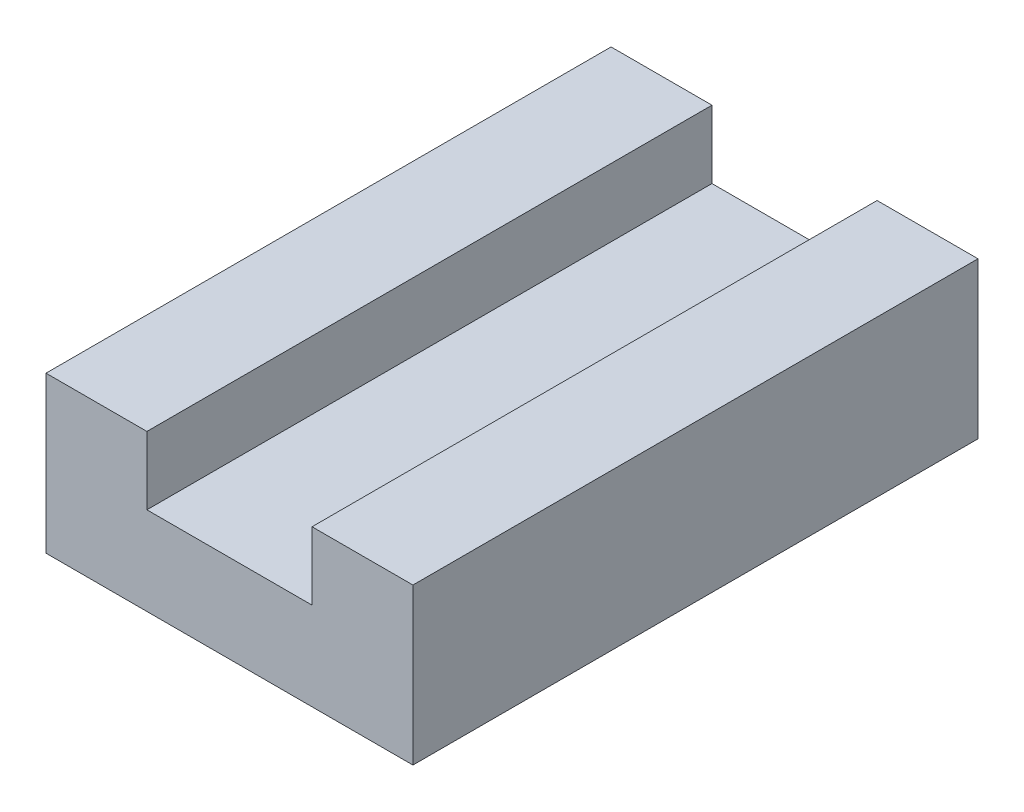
SolidWorks part; units mm, degrees
ref_plane "Front Plane" through (0, 0, 0) normal (0, 0, 1) x (1, 0, 0)
ref_plane "Top Plane" through (0, 0, 0) normal (0, 1, 0) x (1, 0, 0)
ref_plane "Right Plane" through (0, 0, 0) normal (1, 0, 0) x (0, 0, -1)
sketch "Sketch1" plane through (0, 0, 0) normal (1, 0, 0) x (0, 0, -1)
  line L1 (0, 0) -> (30.8, 0)
  line L2 (0, 0) -> (0, 8.5)
  line L3 (0, 8.5) -> (30.8, 8.5)
  line L4 (30.8, 0) -> (30.8, 8.5)
  dimension "D1" = 30.8
  dimension "D2" = 8.5
extrude "Boss-Extrude1" add sketch "Sketch1" along normal mid plane 20
sketch "Sketch2" plane through (0, 8.5, 0) normal (0, 1, 0) x (1, 0, 0)
  line L0 (10, 0) -> (-10, 0) construction
  line L1 (-4.5, 0) -> (4.5, 0)
  line L2 (-4.5, 0) -> (-4.5, 30.8)
  line L3 (-4.5, 30.8) -> (4.5, 30.8)
  line L4 (4.5, 0) -> (4.5, 30.8)
  line L5 (10, 30.8) -> (-10, 30.8) construction
  line L6 (10, 30.8) -> (10, 0) construction
  dimension "D1" = 9
  dimension "D2" = 5.5
extrude "Cut-Extrude1" cut sketch "Sketch2" against normal blind 3.7
hole_wizard "M3x0.5 Tapped Hole1" positions "Sketch4" profile "Sketch3" tap size "M3x0.5" standard "ANSI Metric"
sketch "Sketch4" plane through (0, 0, 0) normal (0, -1, 0) x (-1, 0, 0)
  line L0 (7.5, 10.4) -> (-7.5, 10.4) construction
  line L1 (-7.5, 10.4) -> (-7.5, 20.4) construction
  line L2 (-7.5, 20.4) -> (7.5, 20.4) construction
  line L3 (7.5, 20.4) -> (7.5, 10.4) construction
  line L5 (-10, 30.8) -> (10, 30.8) construction
  line L6 (10, 0) -> (10, 30.8) construction
  point P0 (7.5, 10.4)
  point P2 (7.5, 20.4)
  point P4 (-7.5, 20.4)
  point P6 (-7.5, 10.4)
  dimension "D1" = 15
  dimension "D2" = 10
  dimension "D3" = 10.4
  dimension "D4" = 2.5
sketch "Sketch3" plane through (-7.5, 0, -10.4) normal (1, 0, 0) x (0, 0, -1)
  line L0 (0, 0) -> (0, 3.5511)
  line L1 (0, 3.5511) -> (1.25, 2.8)
  line L2 (1.25, 2.8) -> (1.25, 0)
  line L5 (1.25, 0) -> (0, 0)
  line L10 (0, 3.5511) -> (-1.25, 2.8) construction
  line L11 (0, -6.35) -> (0, 107.95) construction
  dimension "Tap Drill Dia." = 2.5
  dimension "Tap Drill Depth" = 2.8
  dimension "Drill Angle" = 118
